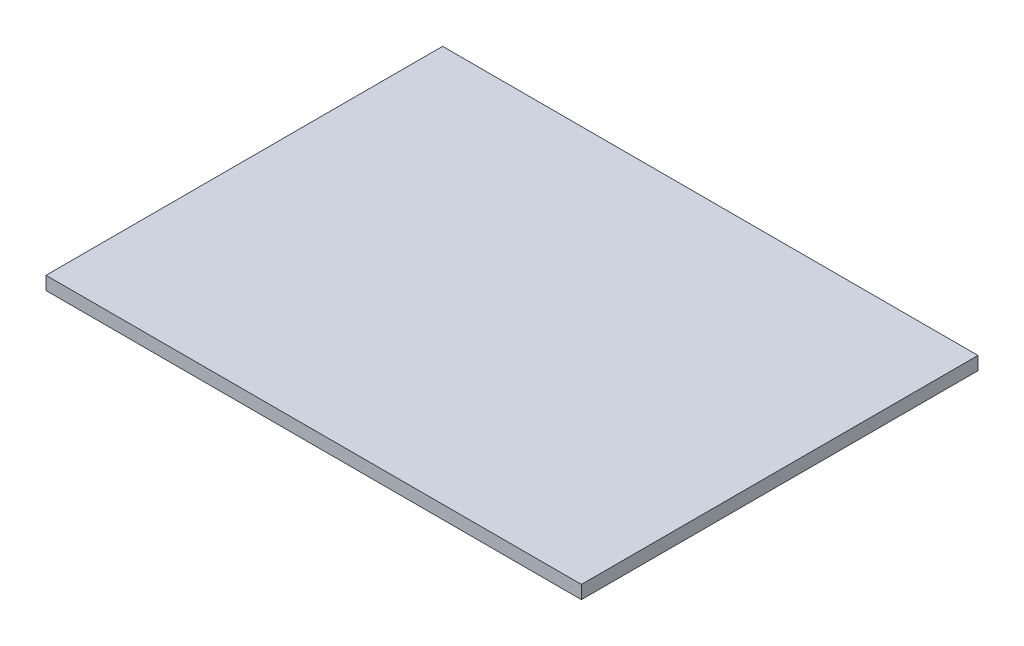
SolidWorks part; units mm, degrees
ref_plane "Front" through (0, 0, 0) normal (0, 0, 1) x (1, 0, 0)
ref_plane "Top" through (0, 0, 0) normal (0, 1, 0) x (1, 0, 0)
ref_plane "Right" through (0, 0, 0) normal (1, 0, 0) x (0, 0, -1)
sketch "Sketch1" plane through (0, 0, 0) normal (0, 1, 0) x (1, 0, 0)
  line L1 (-20.25, -15) -> (20.25, -15)
  line L2 (-20.25, -15) -> (-20.25, 15)
  line L3 (-20.25, 15) -> (20.25, 15)
  line L4 (20.25, -15) -> (20.25, 15)
  line L5 (-20.25, -15) -> (20.25, 15) construction
  line L6 (-20.25, 15) -> (20.25, -15) construction
  point P0 (0, 0)
  dimension "D1" = 40.5
  dimension "D2" = 30
extrude "Boss-Extrude1" add sketch "Sketch1" along normal mid plane 1
